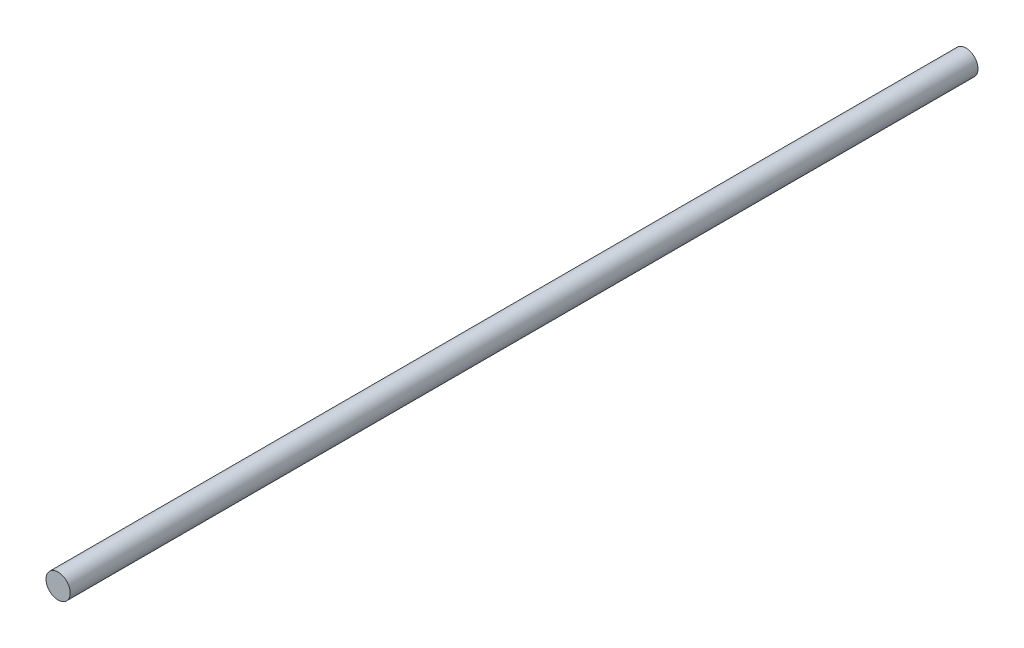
SolidWorks part; units mm, degrees
ref_plane "Front Plane" through (0, 0, 0) normal (0, 0, 1) x (1, 0, 0)
ref_plane "Top Plane" through (0, 0, 0) normal (0, 1, 0) x (1, 0, 0)
ref_plane "Right Plane" through (0, 0, 0) normal (1, 0, 0) x (0, 0, -1)
sketch "Sketch1" plane through (0, 0, 0) normal (0, 0, 1) x (1, 0, 0)
  circle A0 centre (0, 0) radius 30
  dimension "D1" = 60
extrude "Boss-Extrude1" add sketch "Sketch1" against normal blind 2250
